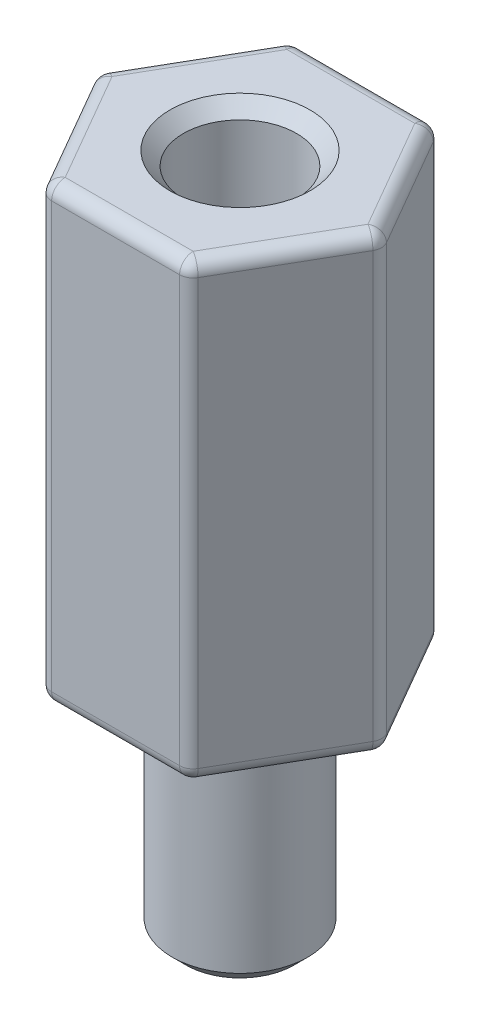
SolidWorks part; units mm, degrees
ref_plane "Front Plane" through (0, 0, 0) normal (0, 0, 1) x (1, 0, 0)
ref_plane "Top Plane" through (0, 0, 0) normal (0, 1, 0) x (1, 0, 0)
ref_plane "Right Plane" through (0, 0, 0) normal (1, 0, 0) x (0, 0, -1)
sketch "Sketch1" plane through (0, 0, 0) normal (0, 1, 0) x (1, 0, 0)
  line L1 (-1.5877, 2.75) -> (-3.1754, 0)
  line L2 (-3.1754, 0) -> (-1.5877, -2.75)
  line L3 (-1.5877, -2.75) -> (1.5877, -2.75)
  line L4 (1.5877, -2.75) -> (3.1754, 0)
  line L5 (3.1754, 0) -> (1.5877, 2.75)
  line L6 (1.5877, 2.75) -> (-1.5877, 2.75)
  circle A0 centre (0, 0) radius 2.75 construction
  circle A1 centre (0, 0) radius 1.25
  dimension "D2" = 2.5
  dimension "D1" = 5.5
extrude "Boss-Extrude1" add sketch "Sketch1" along normal blind 10
fillet "Fillet1" radius 0.3 6 edges at (1.5877, 5, -2.75) (3.1754, 5, 0) (-1.5877, 5, -2.75) (-3.1754, 5, 0) (-1.5877, 5, 2.75) (1.5877, 5, 2.75)
fillet "Fillet2" radius 0.3 24 edges at (-1.5645, 0, 2.7098) (-2.3816, 0, 1.375) (-3.129, 0, 0) (-2.3816, 0, -1.375) (-1.5645, 0, -2.7098) (0, 0, -2.75) (1.5645, 0, -2.7098) (2.3816, 0, -1.375) (3.129, 0, 0) (2.3816, 0, 1.375) (1.5645, 0, 2.7098) (-1.5645, 10, 2.7098) (-2.3816, 10, 1.375) (-3.129, 10, 0) (-2.3816, 10, -1.375) (-1.5645, 10, -2.7098) (0, 10, -2.75) (1.5645, 10, -2.7098) (2.3816, 10, -1.375) (3.129, 10, 0) (2.3816, 10, 1.375) (1.5645, 10, 2.7098) (0, 0, 2.75) (0, 10, 2.75)
sketch "Sketch2" plane through (0, 0, 0) normal (0, -1, 0) x (1, 0, 0)
  circle A0 centre (0, 0) radius 1.5
  dimension "D1" = 3
extrude "Boss-Extrude2" add sketch "Sketch2" along normal blind 5
chamfer "Chamfer1" distance 0.3 angle 45 2 edges at (0, 10, 1.25) (0, -5, -1.5)
fillet "Fillet3" radius 0.3 1 edges at (0, 0, 1.5)
